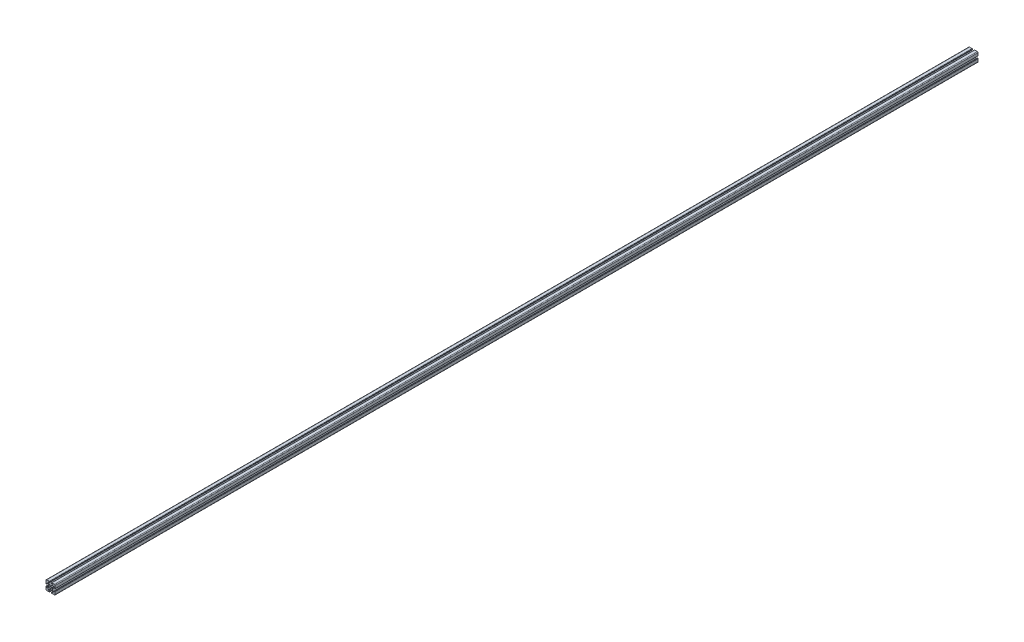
SolidWorks part; units mm, degrees
ref_plane "Front Plane" through (0, 0, 0) normal (0, 0, 1) x (1, 0, 0)
ref_plane "Top Plane" through (0, 0, 0) normal (0, 1, 0) x (1, 0, 0)
ref_plane "Right Plane" through (0, 0, 0) normal (1, 0, 0) x (0, 0, -1)
sketch "Sketch1" plane through (0, 0, 0) normal (0, 0, 1) x (1, 0, 0)
  line L0 (0, 19.7407) -> (0, -19.7407) construction
  line L1 (19.0335, 0) -> (-20.7246, 0) construction
  line L2 (-8.715, -15.5246) -> (-5.63, -15.5246)
  line L3 (-10.285, -13.9546) -> (-10.285, -13.4925)
  line L4 (-6.2171, -9.1098) -> (-10.0624, -12.9551)
  line L5 (2.7773, -7.685) -> (-2.7773, -7.685)
  line L6 (10.0624, -12.9551) -> (6.2171, -9.1098)
  line L7 (10.285, -13.9546) -> (10.285, -13.4925)
  line L8 (5.63, -15.5246) -> (8.715, -15.5246)
  line L9 (4.06, -18.43) -> (4.06, -17.0946)
  line L10 (-4.06, -18.43) -> (-4.06, -17.0946)
  line L11 (15.68, -8.7154) -> (15.68, -5.63)
  line L12 (-14.11, -10.2854) -> (-13.8169, -10.2854)
  line L13 (20, -16.83) -> (20, -5.63)
  line L14 (20, 5.63) -> (20, 13.0011)
  line L15 (-16.83, 20) -> (-5.63, 20)
  line L16 (5.63, 20) -> (12.9796, 20)
  line L18 (-8.715, 15.5246) -> (-5.63, 15.5246)
  line L19 (-20, -17.0184) -> (-20, -5.7579)
  line L20 (-20, 5.573) -> (-20, 13.0045)
  line L21 (-15.68, -8.7154) -> (-15.68, -5.7579)
  line L23 (-16.6746, -20) -> (-5.63, -20)
  line L24 (5.63, -20) -> (13, -20)
  line L53 (14.11, -10.2854) -> (13.6201, -10.2854)
  line L54 (13.1637, -9.947) -> (9.0762, -5.8595)
  line L55 (7.685, -2.5008) -> (7.685, 2.5008)
  line L56 (9.0762, 5.8595) -> (13.2795, 10.0628)
  line L57 (13.8169, 10.2854) -> (14.11, 10.2854)
  line L58 (15.68, 8.7154) -> (15.68, 5.63)
  line L59 (17.25, 4.06) -> (18.43, 4.06)
  line L61 (20, 13.0011) -> (20, 16.83)
  line L62 (16.83, 20) -> (12.9796, 20)
  line L64 (4.06, 18.43) -> (4.06, 17.0946)
  line L65 (5.63, 15.5246) -> (8.715, 15.5246)
  line L66 (10.285, 13.9546) -> (10.285, 13.4925)
  line L67 (10.0624, 12.9551) -> (6.2171, 9.1098)
  line L68 (2.7773, 7.685) -> (-2.7773, 7.685)
  line L69 (-6.2171, 9.1098) -> (-10.0624, 12.9551)
  line L70 (-10.285, 13.4925) -> (-10.285, 13.9546)
  line L72 (-4.06, 17.0946) -> (-4.06, 18.43)
  line L75 (-20, 16.83) -> (-20, 13.0045)
  line L77 (-18.43, 4.003) -> (-17.25, 4.003)
  line L78 (-15.68, 5.573) -> (-15.68, 8.4757)
  line L79 (-14.0552, 10.0447) -> (-13.7199, 10.033)
  line L80 (-13.0405, 9.8238) -> (-9.0762, 5.8595)
  line L81 (-7.685, 2.5008) -> (-7.685, -2.5008)
  line L82 (-9.0762, -5.8595) -> (-13.2795, -10.0628)
  line L85 (-17.25, -4.1204) -> (-18.43, -4.1204)
  line L100 (13, -20) -> (16.83, -20)
  line L103 (18.43, -4.06) -> (17.25, -4.06)
  arc A0 (-5.63, -15.5246) -> (-4.06, -17.0946) centre (-5.63, -17.0946) cw
  arc A1 (-8.715, -15.5246) -> (-10.285, -13.9546) centre (-8.715, -13.9546) cw
  arc A2 (-10.285, -13.4925) -> (-10.0624, -12.9551) centre (-9.525, -13.4925) cw
  arc A3 (-6.2171, -9.1098) -> (-2.7773, -7.685) centre (-2.7773, -12.5496) cw
  arc A4 (2.7773, -7.685) -> (6.2171, -9.1098) centre (2.7773, -12.5496) cw
  arc A5 (10.0624, -12.9551) -> (10.285, -13.4925) centre (9.525, -13.4925) cw
  arc A6 (10.285, -13.9546) -> (8.715, -15.5246) centre (8.715, -13.9546) cw
  arc A7 (4.06, -17.0946) -> (5.63, -15.5246) centre (5.63, -17.0946) cw
  arc A8 (5.63, -20) -> (4.06, -18.43) centre (5.63, -18.43) cw
  arc A9 (-4.06, -18.43) -> (-5.63, -20) centre (-5.63, -18.43) cw
  circle A45 centre (0, 0) radius 3.4
  arc A46 (17.25, -4.06) -> (15.68, -5.63) centre (17.25, -5.63) ccw
  arc A47 (14.11, -10.2854) -> (15.68, -8.7154) centre (14.11, -8.7154) ccw
  arc A48 (13.1637, -9.947) -> (13.6201, -10.2854) centre (13.8117, -9.55) ccw
  arc A49 (7.685, -2.5008) -> (9.0762, -5.8595) centre (12.435, -2.5008) ccw
  arc A50 (9.0762, 5.8595) -> (7.685, 2.5008) centre (12.435, 2.5008) ccw
  arc A51 (13.8169, 10.2854) -> (13.2795, 10.0628) centre (13.8169, 9.5254) ccw
  arc A52 (15.68, 8.7154) -> (14.11, 10.2854) centre (14.11, 8.7154) ccw
  arc A53 (15.68, 5.63) -> (17.25, 4.06) centre (17.25, 5.63) ccw
  arc A54 (18.43, 4.06) -> (20, 5.63) centre (18.43, 5.63) ccw
  arc A55 (20, 16.83) -> (16.83, 20) centre (16.83, 16.83) ccw
  arc A56 (5.63, 20) -> (4.06, 18.43) centre (5.63, 18.43) ccw
  arc A57 (4.06, 17.0946) -> (5.63, 15.5246) centre (5.63, 17.0946) ccw
  arc A58 (10.285, 13.9546) -> (8.715, 15.5246) centre (8.715, 13.9546) ccw
  arc A59 (10.0624, 12.9551) -> (10.285, 13.4925) centre (9.525, 13.4925) ccw
  arc A60 (2.7773, 7.685) -> (6.2171, 9.1098) centre (2.7773, 12.5496) ccw
  arc A61 (-6.2171, 9.1098) -> (-2.7773, 7.685) centre (-2.7773, 12.5496) ccw
  arc A62 (-10.285, 13.4925) -> (-10.0624, 12.9551) centre (-9.525, 13.4925) ccw
  arc A63 (-8.715, 15.5246) -> (-10.285, 13.9546) centre (-8.715, 13.9546) ccw
  arc A64 (-5.63, 15.5246) -> (-4.06, 17.0946) centre (-5.63, 17.0946) ccw
  arc A65 (-4.06, 18.43) -> (-5.63, 20) centre (-5.63, 18.43) ccw
  arc A66 (-16.83, 20) -> (-20, 16.83) centre (-16.83, 16.83) ccw
  arc A67 (-20, 5.573) -> (-18.43, 4.003) centre (-18.43, 5.573) ccw
  arc A68 (-17.25, 4.003) -> (-15.68, 5.573) centre (-17.25, 5.573) ccw
  arc A69 (-14.0552, 10.0447) -> (-15.68, 8.4757) centre (-14.11, 8.4757) ccw
  arc A70 (-13.0405, 9.8238) -> (-13.7199, 10.033) centre (-13.5779, 9.2864) ccw
  arc A71 (-7.685, 2.5008) -> (-9.0762, 5.8595) centre (-12.435, 2.5008) ccw
  arc A72 (-9.0762, -5.8595) -> (-7.685, -2.5008) centre (-12.435, -2.5008) ccw
  arc A73 (-13.8169, -10.2854) -> (-13.2795, -10.0628) centre (-13.8169, -9.5254) ccw
  arc A74 (-15.68, -8.7154) -> (-14.11, -10.2854) centre (-14.11, -8.7154) ccw
  arc A75 (-15.68, -5.7579) -> (-17.25, -4.1204) centre (-17.2485, -5.6904) ccw
  arc A76 (-18.43, -4.1204) -> (-20, -5.7579) centre (-18.4315, -5.6904) ccw
  arc A77 (-20, -17.0184) -> (-16.6746, -20) centre (-16.8354, -16.8341) ccw
  arc A88 (16.83, -20) -> (20, -16.83) centre (16.83, -16.83) ccw
  arc A89 (20, -5.63) -> (18.43, -4.06) centre (18.43, -5.63) ccw
  dimension "D2" = 6.8
  dimension "D7" = 20.57
  dimension "D1" = 40
  dimension "D3" = 4.32
  dimension "D4" = 15.37
  dimension "D5" = 20
  dimension "D6" = 4.32
  dimension "D9" = 15.37
extrude "Extrude1" add sketch "Sketch1" against normal blind 4000
